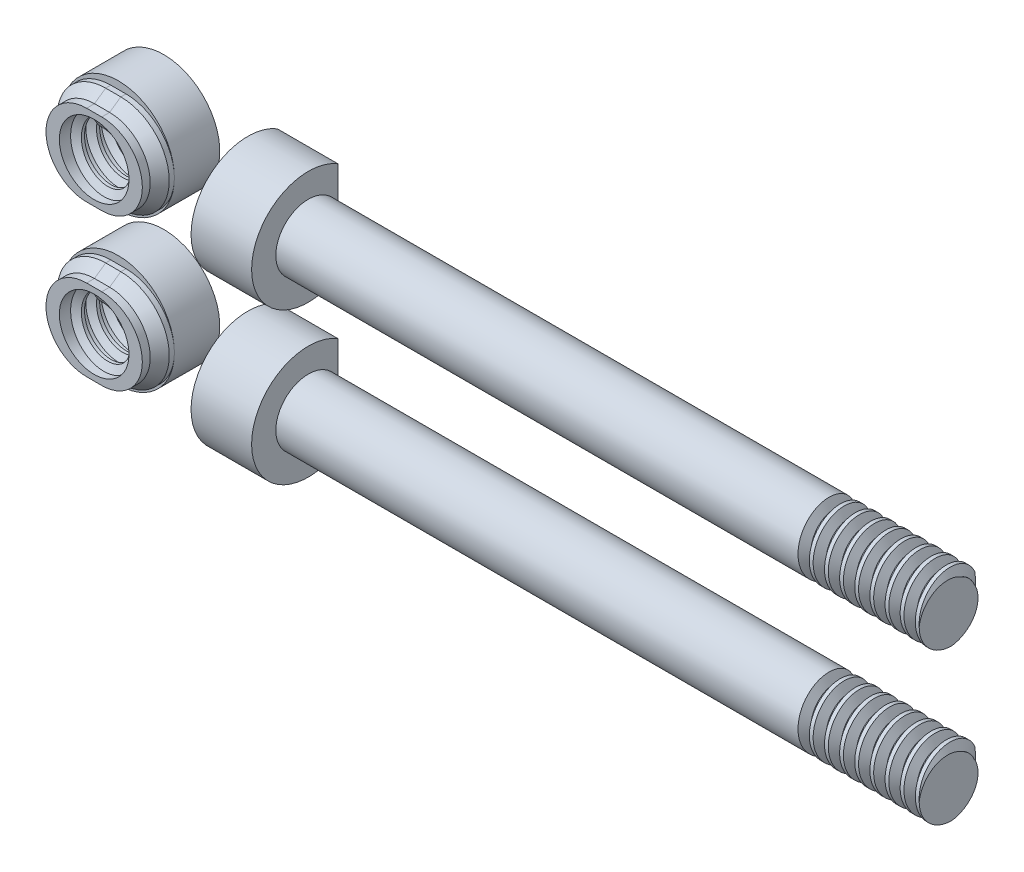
SolidWorks part; units mm, degrees
ref_plane "Front Plane" through (0, 0, 0) normal (0, 0, 1) x (1, 0, 0)
ref_plane "Top Plane" through (0, 0, 0) normal (0, 1, 0) x (1, 0, 0)
ref_plane "Right Plane" through (0, 0, 0) normal (1, 0, 0) x (0, 0, -1)
sketch "Sketch1" plane through (0, 0, 0) normal (0, 0, 1) x (1, 0, 0)
  line L0 (-6.35, 2.4765) -> (6.35, 2.4765) construction
  line L1 (-6.35, 0) -> (0, 0) construction
  line L2 (-6.35, -0.254) -> (-6.35, 0) construction
  line L3 (-6.35, 0) -> (-6.35, 2.4765) construction
  line L4 (0, 0) -> (0, 2.4765) construction
  circle A0 centre (-6.35, 2.4765) radius 2.7305
  circle A1 centre (6.35, 2.4765) radius 2.7305
  dimension "D1" = 5.461
  dimension "D2" = 12.7
  dimension "D3" = 0.254
extrude "Boss-Extrude1" add sketch "Sketch1" along normal blind 53.975
sketch "Sketch2" plane through (0, 0, 53.975) normal (0, 0, 1) x (1, 0, 0)
  circle A0 centre (-6.35, 2.4765) radius 4.7625
  circle A1 centre (6.35, 2.4765) radius 4.7625
  dimension "D1" = 9.525
extrude "Boss-Extrude2" add sketch "Sketch2" along normal blind 5.08
sketch "Sketch3" plane through (0, 0, 59.055) normal (0, 0, 1) x (1, 0, 0)
  line L0 (-6.35, 0.4445) -> (-6.35, 4.5085) construction
  line L3 (-6.858, 0.4445) -> (-6.858, 4.5085)
  line L6 (-5.842, 0.4445) -> (-5.842, 4.5085)
  line L7 (6.35, 0.4445) -> (6.35, 4.5085) construction
  line L8 (5.842, 0.4445) -> (5.842, 4.5085)
  line L9 (6.858, 0.4445) -> (6.858, 4.5085)
  circle A5 centre (6.35, 2.4765) radius 4.7625 construction
  circle A6 centre (-6.35, 2.4765) radius 4.7625 construction
  circle A7 centre (6.35, 2.4765) radius 4.7625 construction
  circle A8 centre (-6.35, 2.4765) radius 4.7625 construction
  arc A9 (-6.858, 0.4445) -> (-5.842, 0.4445) centre (-6.35, 0.4445) ccw
  arc A10 (-5.842, 4.5085) -> (-6.858, 4.5085) centre (-6.35, 4.5085) ccw
  arc A11 (5.842, 0.4445) -> (6.858, 0.4445) centre (6.35, 0.4445) ccw
  arc A12 (6.858, 4.5085) -> (5.842, 4.5085) centre (6.35, 4.5085) ccw
  point P7 (-6.35, 2.4765)
  point P13 (6.35, 2.4765)
  dimension "D1" = 4.064
  dimension "D2" = 1.016
  dimension "D3" = 1.016
extrude "Cut-Extrude1" cut sketch "Sketch3" against normal blind 3.81
thread "Thread1" pitch 1.27 start angle 0, offset 1.27, length 11.43, pitch 1.27, diameter 5.461
ref_plane "Plane1" through (9.0805, 2.4765, -1.27) normal (0, 1, 0) x (-1, 0, 0)
sketch "Thread Profile1" plane through (9.0805, 2.4765, -1.27) normal (0, 1, 0) x (-1, 0, 0)
  line L0 (0, 0) -> (0, 1.27) construction
  line L1 (0, 0) -> (0.6874, 0.3969)
  line L2 (0.6874, 0.3969) -> (0.6874, 0.5556)
  line L3 (0.6874, 0.5556) -> (0, 0.9525)
  line L4 (0.6874, 0.4762) -> (0, 0.4762) construction
  line L11 (0, 0) -> (0, 0.9525)
  point P2 (0, 0)
  dimension "Pitch" = 1.27
  dimension "Profile_Angle" = 60
  dimension "Profile_Land" = 0.1588
  dimension "Profile_Height" = 0.6874
thread "Thread2" pitch 1.27 start angle 0, offset 1.27, length 11.43, pitch 1.27, diameter 5.461
ref_plane "Plane2" through (-3.6195, 2.4765, -1.27) normal (0, 1, 0) x (-1, 0, 0)
sketch "Thread Profile2" plane through (-3.6195, 2.4765, -1.27) normal (0, 1, 0) x (-1, 0, 0)
  line L0 (0, 0) -> (0, 1.27) construction
  line L1 (0, 0) -> (0.6874, 0.3969)
  line L2 (0.6874, 0.3969) -> (0.6874, 0.5556)
  line L3 (0.6874, 0.5556) -> (0, 0.9525)
  line L4 (0.6874, 0.4762) -> (0, 0.4762) construction
  line L11 (0, 0) -> (0, 0.9525)
  point P2 (0, 0)
  dimension "Pitch" = 1.27
  dimension "Profile_Angle" = 60
  dimension "Profile_Land" = 0.1588
  dimension "Profile_Height" = 0.6874
sketch "Sketch9" plane through (0, 0, 0) normal (0, 1, 0) x (1, 0, 0)
  line L0 (-11.1125, -59.055) -> (-1.5875, -59.055) construction
  line L2 (1.5875, -59.055) -> (11.1125, -59.055) construction
  line L3 (6.35, -59.055) -> (6.35, -68.58) construction
  line L4 (-6.35, -59.055) -> (-6.35, -68.58) construction
  circle A0 centre (-6.35, -68.58) radius 4.699
  circle A1 centre (6.35, -68.58) radius 4.699
  circle A2 centre (-6.35, -68.58) radius 2.921
  circle A3 centre (6.35, -68.58) radius 2.921
  dimension "D2" = 9.398
  dimension "D3" = 5.842
  dimension "D1" = 9.525
extrude "Boss-Extrude3" add sketch "Sketch9" along normal blind 3.81 separate body
sketch "Sketch11" plane through (0, 3.81, 0) normal (0, 1, 0) x (1, 0, 0)
  line L0 (-6.35, -69.215) -> (-6.35, -67.945) construction
  line L1 (-10.414, -69.215) -> (-10.414, -67.945)
  line L2 (-2.286, -69.215) -> (-2.286, -67.945)
  line L3 (6.35, -69.215) -> (6.35, -67.945) construction
  line L4 (2.286, -69.215) -> (2.286, -67.945)
  line L5 (10.414, -69.215) -> (10.414, -67.945)
  circle A0 centre (6.35, -68.58) radius 4.699 construction
  circle A1 centre (-6.35, -68.58) radius 4.699 construction
  circle A2 centre (6.35, -68.58) radius 4.699 construction
  circle A3 centre (-6.35, -68.58) radius 4.699 construction
  arc A4 (-10.414, -69.215) -> (-2.286, -69.215) centre (-6.35, -69.215) ccw
  arc A5 (-2.286, -67.945) -> (-10.414, -67.945) centre (-6.35, -67.945) ccw
  arc A6 (2.286, -69.215) -> (10.414, -69.215) centre (6.35, -69.215) ccw
  arc A7 (10.414, -67.945) -> (2.286, -67.945) centre (6.35, -67.945) ccw
  circle A8 centre (-6.35, -68.58) radius 2.921
  circle A9 centre (6.35, -68.58) radius 2.921
  circle A10 centre (6.35, -68.58) radius 2.921 construction
  circle A11 centre (-6.35, -68.58) radius 2.921 construction
  point P8 (-6.35, -68.58)
  point P13 (6.35, -68.58)
  dimension "D1" = 8.128
  dimension "D2" = 8.128
extrude "Boss-Extrude4" add sketch "Sketch11" along normal blind 1.3716
chamfer "Chamfer1" distance 0.9398 angle 35 4 edges at (-6.35, 5.1816, 63.881) (-10.414, 5.1816, 68.58) (-2.286, 5.1816, 68.58) (-6.35, 5.1816, 73.279)
sketch "Sketch12" plane through (0, 5.1816, 0) normal (0, 1, 0) x (1, 0, 0)
  line L2 (-2.9441, -69.215) -> (-2.9441, -67.945)
  line L3 (-9.7559, -67.945) -> (-9.7559, -69.215)
  line L4 (-2.9441, -69.215) -> (-2.9441, -67.945)
  line L5 (-9.7559, -67.945) -> (-9.7559, -69.215)
  circle A0 centre (-6.35, -68.58) radius 2.921 construction
  circle A1 centre (-6.35, -68.58) radius 2.921
  arc A2 (-2.9441, -67.945) -> (-9.7559, -67.945) centre (-6.35, -67.945) ccw
  arc A3 (-9.7559, -69.215) -> (-2.9441, -69.215) centre (-6.35, -69.215) ccw
  arc A4 (-2.9441, -67.945) -> (-9.7559, -67.945) centre (-6.35, -67.945) ccw
  arc A5 (-9.7559, -69.215) -> (-2.9441, -69.215) centre (-6.35, -69.215) ccw
  dimension "D1" = 0
extrude "Boss-Extrude5" add sketch "Sketch12" along normal blind 0.6604
chamfer "Chamfer2" distance 0.9398 angle 35 4 edges at (6.35, 5.1816, 63.881) (2.286, 5.1816, 68.58) (10.414, 5.1816, 68.58) (6.35, 5.1816, 73.279)
sketch "Sketch13" plane through (0, 5.1816, 0) normal (0, 1, 0) x (1, 0, 0)
  line L2 (9.7559, -69.215) -> (9.7559, -67.945)
  line L3 (2.9441, -67.945) -> (2.9441, -69.215)
  line L4 (9.7559, -69.215) -> (9.7559, -67.945)
  line L5 (2.9441, -67.945) -> (2.9441, -69.215)
  circle A1 centre (6.35, -68.58) radius 2.921
  circle A2 centre (6.35, -68.58) radius 2.921
  arc A4 (9.7559, -67.945) -> (2.9441, -67.945) centre (6.35, -67.945) ccw
  arc A5 (2.9441, -69.215) -> (9.7559, -69.215) centre (6.35, -69.215) ccw
  arc A6 (9.7559, -67.945) -> (2.9441, -67.945) centre (6.35, -67.945) ccw
  arc A7 (2.9441, -69.215) -> (9.7559, -69.215) centre (6.35, -69.215) ccw
  dimension "D1" = 0
  dimension "D2" = 0
extrude "Boss-Extrude6" add sketch "Sketch13" along normal blind 0.6604
thread "Thread3" pitch 1.0583 start angle 0, offset 0, length 6.35, pitch 1.27, diameter 5.842
ref_plane "Plane3" through (-9.271, 5.842, 68.58) normal (0, 0, 1) x (-1, 0, 0)
sketch "Thread Profile3" plane through (-9.271, 5.842, 68.58) normal (0, 0, 1) x (-1, 0, 0)
  line L0 (0, 0) -> (0, 1.0583) construction
  line L11 (0, 0) -> (0, 0.926)
  line L12 (0, 0.926) -> (-0.5728, 0.5953)
  line L13 (-0.5728, 0.5953) -> (-0.5728, 0.3307)
  line L15 (-0.5728, 0.3307) -> (0, 0)
  line L17 (-0.5728, 0.463) -> (0, 0.463) construction
  point P2 (0, 0)
  dimension "Pitch" = 1.0583
  dimension "Profile_Angle" = 60
  dimension "Profile_Land" = 0.2646
  dimension "Profile_Height" = 0.5728
thread "Thread4" pitch 1.0583 start angle 0, offset 0, length 6.35, pitch 1.27, diameter 5.842
ref_plane "Plane4" through (3.429, 5.842, 68.58) normal (0, 0, 1) x (-1, 0, 0)
sketch "Thread Profile4" plane through (3.429, 5.842, 68.58) normal (0, 0, 1) x (-1, 0, 0)
  line L0 (0, 0) -> (0, 1.0583) construction
  line L11 (0, 0) -> (0, 0.926)
  line L12 (0, 0.926) -> (-0.5728, 0.5953)
  line L13 (-0.5728, 0.5953) -> (-0.5728, 0.3307)
  line L15 (-0.5728, 0.3307) -> (0, 0)
  line L17 (-0.5728, 0.463) -> (0, 0.463) construction
  point P2 (0, 0)
  dimension "Pitch" = 1.0583
  dimension "Profile_Angle" = 60
  dimension "Profile_Land" = 0.2646
  dimension "Profile_Height" = 0.5728
sketch "Sketch8" plane through (0, 0, 0) normal (0, 0, 1) x (1, 0, 0)
  line L1 (-12.7, 0) -> (12.7, 0)
  line L2 (-12.7, 0) -> (-12.7, -3.81)
  line L3 (-12.7, -3.81) -> (12.7, -3.81)
  line L4 (12.7, 0) -> (12.7, -3.81)
  point P9 (0, 0)
  dimension "D1" = 3.81
  dimension "D2" = 25.4
extrude "Cut-Extrude2" cut sketch "Sketch8" against normal through all both and the other way through all
move or copy body "Body-Move/Copy1" bodies to move or copy 110 109 119 120 copy no rotation origin (17.3512, -14.2356, 31.5868) rotation axis (0.5774, -0.5774, -0.5774) rotation angle 120
